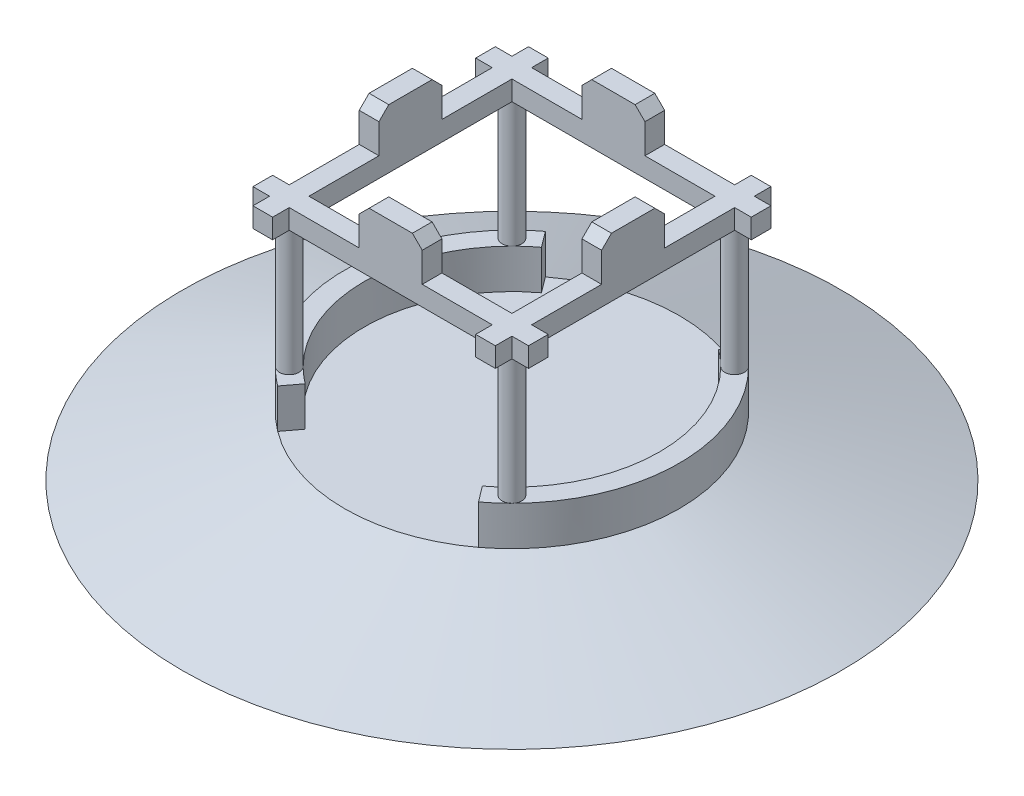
SolidWorks part; units mm, degrees
ref_plane "前视基准面" through (0, 0, 0) normal (0, 0, 1) x (1, 0, 0)
ref_plane "上视基准面" through (0, 0, 0) normal (0, 1, 0) x (1, 0, 0)
ref_plane "右视基准面" through (0, 0, 0) normal (1, 0, 0) x (0, 0, -1)
sketch "草图1" plane through (0, 0, 0) normal (0, 0, 1) x (1, 0, 0)
  line L0 (0, 105.1547) -> (0, -556.4125) construction
  line L1 (0, 0) -> (-850, 0)
  line L2 (-850, 0) -> (-1674.2432, -300)
  line L3 (-1674.2432, -300) -> (0, -300)
  line L4 (0, -300) -> (0, 0)
  point P5 (0, -556.4125)
  dimension "D1" = 20
  dimension "D2" = 850
  dimension "D3" = 300
revolve "旋转1" add sketch "草图1" angle 360 about L0
sketch "草图2" plane through (0, 0, 0) normal (0, 1, 0) x (1, 0, 0)
  line L0 (-2311.0579, 0) -> (3567.8511, 0) construction
  line L1 (0, 1840.4511) -> (0, -1835.7259) construction
  line L2 (450, -600) -> (510, -680)
  line L5 (0, 0) -> (-450, 600)
  line L6 (-450, 600) -> (-510, 680)
  line L7 (450, 600) -> (510, 680)
  line L8 (-450, -600) -> (-510, -680)
  arc A0 (-510, 680) -> (-510, -680) centre (0, 0) ccw
  arc A1 (-450, 600) -> (-450, -600) centre (0, 0) ccw
  arc A3 (450, -600) -> (450, 600) centre (0, 0) ccw
  arc A4 (510, -680) -> (510, 680) centre (0, 0) ccw
  point P17 (510, -680)
  dimension "D1" = 450
  dimension "D2" = 1500
  dimension "D3" = 850
extrude "凸台-拉伸1" add sketch "草图2" along normal blind 200 contours A1 L6 L8 M7 | A3 L2 L7 M7
sketch "草图3" plane through (0, 200, 0) normal (0, 1, 0) x (1, 0, 0)
  line L0 (0, 2510.8395) -> (0, -2510.8395) construction
  line L1 (-2809.1339, 0) -> (2703.9251, 0) construction
  line L2 (-1939.9941, 1939.9941) -> (0, 0) construction
  line L3 (0, 0) -> (2558.4276, -2558.4276) construction
  circle A0 centre (565.6854, -565.6854) radius 50
  point P9 (541.5601, -590.4702)
  point P11 (516.301, -606.9302)
  point P12 (0, 0)
  point P13 (563.819, -563.819)
  dimension "D3" = 100
  dimension "D1" = 45
  dimension "D2" = 800
extrude "凸台-拉伸2" add sketch "草图3" along normal blind 650
pattern_circular "阵列(圆周)1" count 4 over 360 about axis through (0, 0, 0) along (0, 1, 0) of "凸台-拉伸2"
sketch "草图4" plane through (0, 850, 0) normal (0, 1, 0) x (1, 0, 0)
  line L0 (565.6854, 565.6854) -> (565.6854, -565.6854) construction
  line L2 (515.6854, -700) -> (615.6854, -700)
  line L3 (515.6854, -700) -> (515.6854, 700)
  line L4 (515.6854, 700) -> (615.6854, 700)
  line L5 (615.6854, -700) -> (615.6854, 700)
  line L6 (565.6854, 700) -> (565.6854, -700) construction
  line L7 (515.6854, 0) -> (615.6854, 0) construction
  point P4 (565.6854, 0)
  point P8 (510, 712.0022)
  point P10 (501.7317, 618.0865)
  point P11 (396.0766, 671.7526)
  dimension "D1" = 100
  dimension "D2" = 1400
extrude "凸台-拉伸3" add sketch "草图4" along normal blind 100
sketch "草图5" plane through (0, 950, 0) normal (0, 1, 0) x (1, 0, 0)
  line L0 (615.6854, -700) -> (615.6854, 700) construction
  line L1 (515.6854, 160) -> (615.6854, 160)
  line L2 (515.6854, 160) -> (515.6854, -160)
  line L3 (515.6854, -160) -> (615.6854, -160)
  line L4 (615.6854, 160) -> (615.6854, -160)
  line L5 (565.6854, -160) -> (565.6854, 160) construction
  line L6 (515.6854, 0) -> (615.6854, 0) construction
  line L7 (515.6854, 700) -> (515.6854, -700) construction
  line L8 (515.6854, -700) -> (615.6854, -700) construction
  point P0 (565.6854, 0)
  dimension "D1" = 320
  dimension "D2" = 700
extrude "凸台-拉伸4" add sketch "草图5" along normal blind 200
chamfer "倒角1" distance 50 angle 45 2 edges at (565.6854, 1150, -160) (565.6854, 1150, 160)
pattern_circular "阵列(圆周)2" count 4 over 360 about axis through (0, 0, 0) along (0, 1, 0) of "凸台-拉伸3", "凸台-拉伸4", "倒角1"
